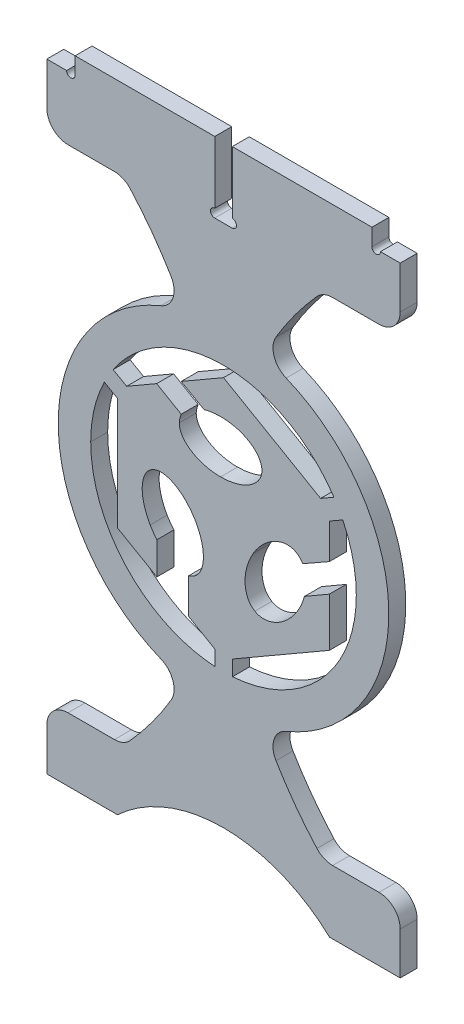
SolidWorks part; units mm, degrees
ref_plane "Front Plane" through (0, 0, 0) normal (0, 0, 1) x (1, 0, 0)
ref_plane "Top Plane" through (0, 0, 0) normal (0, 1, 0) x (1, 0, 0)
ref_plane "Right Plane" through (0, 0, 0) normal (1, 0, 0) x (0, 0, -1)
sketch "Leg_Profile" plane through (0, 0, 0) normal (0, 0, 1) x (1, 0, 0)
  line L0 (-125, 219) -> (125, -219) construction
  line L1 (-105, 231) -> (105, 231)
  line L2 (-125, 219) -> (-125, -219)
  line L3 (-125, -219) -> (-75, -219)
  line L4 (125, 219) -> (125, -219)
  line L5 (75, -219) -> (125, -219)
  line L8 (-125, 219) -> (-111, 219)
  line L9 (-105, 231) -> (-105, 219)
  line L12 (125, 219) -> (111, 219)
  line L13 (105, 231) -> (105, 219)
  arc A0 (75, -219) -> (-75, -219) centre (0, -299.4674) ccw
  arc A2 (-111, 219) -> (-105, 219) centre (-108, 219) ccw
  arc A3 (105, 219) -> (111, 219) centre (108, 219) ccw
  dimension "Dogbone_Radius" = 3
  dimension "Bottom_Arch_Radius" = 110
  dimension "Leg_Height" = 450
  dimension "Shoulder_Height" = 12
  dimension "Shoulder_Width" = 20
  dimension "Leg_Width" = 250
  dimension "Foot_Width" = 50
extrude "Leg_Extrude" add sketch "Leg_Profile" along normal blind 12
sketch "Sketch2" plane through (0, 0, 12) normal (0, 0, 1) x (1, 0, 0)
  line L0 (-50.1391, -37.6194) -> (-50.1391, -54.1629) construction
  line L1 (-50.1391, -54.1629) -> (-71.8697, -41.6194) construction
  line L2 (-71.8697, -41.6194) -> (-71.8697, 37.7466) construction
  line L3 (-71.8697, 37.7466) -> (-85.5342, 45.6353) construction
  line L4 (-3.0682, -96.887) -> (-3.0682, -81.3306) construction
  line L5 (-3.0682, -81.3306) -> (-21.6488, -70.608) construction
  line L6 (-21.6488, -70.608) -> (-21.6488, -49.3871) construction
  line L7 (85.5832, 45.5143) -> (71.8558, 37.5885) construction
  line L8 (71.8558, 37.5885) -> (71.8558, 12.7724) construction
  line L9 (71.8558, 12.7724) -> (56.8736, 4.2789) construction
  line L10 (59.8285, -21.0549) -> (71.8558, -14.0936) construction
  line L11 (71.8558, -14.0936) -> (71.8558, -41.6194) construction
  line L12 (71.8558, -41.6194) -> (3.3834, -81.1483) construction
  line L13 (3.3834, -81.1483) -> (3.3834, -96.8741) construction
  line L14 (-13.3569, 63.0869) -> (-23.8794, 69.0659) construction
  line L15 (-23.8794, 69.0659) -> (-0.0005, 82.8449) construction
  line L16 (-0.0005, 82.8449) -> (68.6736, 43.1966) construction
  line L17 (-68.5487, 43.2788) -> (-47.2858, 55.5514) construction
  line L18 (-47.2858, 55.5514) -> (-33.5439, 47.5885) construction
  line L19 (125, -219) -> (125, 219) construction
  line L20 (74.9, -219) -> (125, -219) construction
  line L21 (-68.5486, 46.7427) -> (-47.2829, 59.0169)
  line L22 (-47.2829, 59.0169) -> (-29.9326, 48.9632)
  line L23 (-13.7964, 59.8861) -> (-29.9167, 69.0458)
  line L24 (-29.9167, 69.0458) -> (-0.0001, 86.3087)
  line L25 (-0.0001, 86.3087) -> (68.673, 46.661)
  line L26 (-74.8697, -43.3516) -> (-74.8697, 36.0145)
  line L27 (-74.8697, 36.0145) -> (-84.3062, 41.4623)
  line L28 (-6.0682, -93.7416) -> (-6.0682, -83.0631)
  line L29 (-6.0682, -83.0631) -> (-24.6488, -72.3405)
  line L30 (-24.6488, -72.3405) -> (-24.6488, -47.3849)
  line L31 (-47.1391, -36.5489) -> (-47.1391, -59.3585)
  line L32 (-47.1391, -59.3585) -> (-74.8697, -43.3516)
  line L33 (57.2919, -19.0568) -> (74.8558, -8.891)
  line L34 (74.8558, -8.891) -> (74.8558, -43.3515)
  line L35 (74.8558, -43.3515) -> (6.3834, -82.8805)
  line L36 (6.3834, -82.8805) -> (6.3834, -93.7186)
  line L37 (84.3509, 41.3386) -> (74.8558, 35.8565)
  line L38 (74.8558, 35.8565) -> (74.8558, 11.0246)
  line L39 (74.8558, 11.0246) -> (56.2033, 0.4504)
  circle A0 centre (0, 0) radius 96.9332 construction
  spline S0 degree 3 poles (-21.6488, -49.3871) (-20.9811, -49.1097) (-20.3327, -48.8081) (-19.7085, -48.4371) knots 0 0 0 0 1 1 1 1 construction
  spline S1 degree 3 poles (-19.7085, -48.4371) (-9.4456, -42.4694) (-8.373, -25.1694) (-17.3133, -9.7711) knots 0 0 0 0 1 1 1 1 construction
  spline S2 degree 3 poles (-17.3133, -9.7711) (-26.2536, 5.6144) (-41.823, 13.2628) (-52.0858, 7.3031) knots 0 0 0 0 1 1 1 1 construction
  spline S3 degree 3 poles (-52.0858, 7.3031) (-62.3487, 1.3499) (-63.4149, -15.9646) (-54.4745, -31.363) knots 0 0 0 0 1 1 1 1 construction
  spline S4 degree 3 poles (-54.4745, -31.363) (-53.1568, -33.6242) (-51.6955, -35.7162) (-50.1391, -37.6194) knots 0 0 0 0 1 1 1 1 construction
  spline S5 degree 3 poles (-85.5342, 45.6353) (-92.8116, 32.0321) (-96.9503, 16.495) (-96.9503, -0.0179) knots 0 0 0 0 1 1 1 1 construction
  spline S6 degree 3 poles (-96.9503, -0.0179) (-96.9503, -52.5323) (-55.1858, -95.2612) (-3.0682, -96.887) knots 0 0 0 0 1 1 1 1 construction
  spline S7 degree 3 poles (56.8736, 4.2789) (55.7833, 5.5515) (54.5043, 6.6418) (53.043, 7.4918) knots 0 0 0 0 1 1 1 1 construction
  spline S8 degree 3 poles (53.043, 7.4918) (42.7785, 13.4531) (27.2108, 5.8031) (18.2705, -9.5824) knots 0 0 0 0 1 1 1 1 construction
  spline S9 degree 3 poles (18.2705, -9.5824) (9.3302, -24.9807) (10.4011, -42.2871) (20.6592, -48.2532) knots 0 0 0 0 1 1 1 1 construction
  spline S10 degree 3 poles (20.6592, -48.2532) (30.9221, -54.2081) (46.4898, -46.5645) (55.4301, -31.1726) knots 0 0 0 0 1 1 1 1 construction
  spline S11 degree 3 poles (55.4301, -31.1726) (57.3639, -27.8468) (58.8268, -24.4323) (59.8285, -21.0549) knots 0 0 0 0 1 1 1 1 construction
  spline S12 degree 3 poles (3.3834, -96.8741) (55.3478, -95.0903) (96.9364, -52.4178) (96.9364, -0.0179) knots 0 0 0 0 1 1 1 1 construction
  spline S13 degree 3 poles (96.9364, -0.0179) (96.9364, 16.445) (92.8171, 31.9385) (85.5832, 45.5143) knots 0 0 0 0 1 1 1 1 construction
  spline S14 degree 3 poles (30.1656, 42.9579) (30.1656, 54.8272) (15.7318, 64.4417) (-2.0666, 64.4417) knots 0 0 0 0 1 1 1 1 construction
  spline S15 degree 3 poles (-2.0666, 64.4417) (-6.0359, 64.4417) (-9.8359, 63.9627) (-13.3569, 63.0869) knots 0 0 0 0 1 1 1 1 construction
  spline S16 degree 3 poles (68.6736, 43.1966) (73.8849, 46.2078) (78.5591, 48.9046) (82.3574, 51.103) knots 0 0 0 0 1 1 1 1 construction
  spline S17 degree 3 poles (82.3574, 51.103) (65.2526, 78.6046) (34.772, 96.9255) (-0.0005, 96.9255) knots 0 0 0 0 1 1 1 1 construction
  spline S18 degree 3 poles (-0.0005, 96.9255) (-34.7278, 96.9255) (-65.1777, 78.6546) (-82.2971, 51.2175) knots 0 0 0 0 1 1 1 1 construction
  spline S19 degree 3 poles (-82.2971, 51.2175) (-78.3648, 48.9417) (-73.6777, 46.2401) (-68.5487, 43.2788) knots 0 0 0 0 1 1 1 1 construction
  spline S20 degree 3 poles (-33.5439, 47.5885) (-34.0359, 46.0949) (-34.3004, 44.5514) (-34.3004, 42.9579) knots 0 0 0 0 1 1 1 1 construction
  spline S21 degree 3 poles (-34.3004, 42.9579) (-34.3004, 31.0934) (-19.8714, 21.4724) (-2.0666, 21.4724) knots 0 0 0 0 1 1 1 1 construction
  spline S22 degree 3 poles (-2.0666, 21.4724) (15.7318, 21.4724) (30.1656, 31.0934) (30.1656, 42.9579) knots 0 0 0 0 1 1 1 1 construction
  spline S23 degree 1 poles (-0.0005, 93.9255) (-78.0652, 52.236) knots 0 0 1 1 construction
  spline S24 degree 1 poles (-78.0652, 52.236) (-68.5486, 46.7427) knots 0 0 1 1 construction
  spline S25 degree 1 poles (-29.9326, 48.9632) (-31.3004, 42.9579) knots 0 0 1 1 construction
  spline S26 degree 1 poles (-31.3004, 42.9579) (-2.0666, 24.4724) knots 0 0 1 1 construction
  spline S27 degree 1 poles (-2.0666, 24.4724) (27.1656, 42.9579) knots 0 0 1 1 construction
  spline S28 degree 1 poles (27.1656, 42.9579) (-2.0666, 61.4417) knots 0 0 1 1 construction
  spline S29 degree 1 poles (-2.0666, 61.4417) (-13.7964, 59.8861) knots 0 0 1 1 construction
  spline S30 degree 1 poles (68.673, 46.661) (78.1297, 52.1235) knots 0 0 1 1 construction
  spline S31 degree 1 poles (78.1297, 52.1235) (-0.0005, 93.9255) knots 0 0 1 1 construction
  spline S32 degree 3 poles (-0.0005, 93.9255) (-2.0204, 93.9255) (-6.0815, 93.7961) (-14.0095, 93.0355) (-23.6501, 91.1738) (-34.6606, 87.5753) (-45.0327, 82.705) (-54.6709, 76.656) (-63.4834, 69.5198) (-71.3714, 61.3972) (-75.9626, 55.3706) (-78.0652, 52.236) knots 0 0 0 0 0.060435 0.120869 0.241739 0.362608 0.483478 0.604347 0.725216 0.846086 0.966955 0.966955 0.966955 0.966955
  spline S33 degree 3 poles (-78.0652, 52.236) (-77.6994, 52.0246) (-76.9746, 51.606) (-75.4696, 50.737) (-73.5234, 49.6137) (-71.0957, 48.2128) (-69.3904, 47.2286) (-68.5486, 46.7427) knots 0.222315 0.222315 0.222315 0.222315 0.307237 0.392159 0.562002 0.731846 0.901689 0.901689 0.901689 0.901689
  spline S34 degree 3 poles (-29.9326, 48.9632) (-30.0259, 48.6801) (-30.212, 48.1147) (-30.4463, 47.4041) (-30.6075, 46.9138) (-30.7038, 46.6226) (-30.8078, 46.2982) (-31.025, 45.5281) (-31.2393, 44.3846) (-31.3004, 43.4312) (-31.3004, 42.9579) knots -0.516261 -0.516261 -0.516261 -0.516261 -0.326728 -0.137196 -0.04243 0.004954 0.052337 0.241869 0.620935 1 1 1 1
  spline S35 degree 3 poles (-31.3004, 42.9579) (-31.3004, 40.6032) (-30.253, 37.226) (-26.8485, 33.0303) (-23.3378, 30.1895) (-18.9778, 27.7846) (-13.899, 25.9379) (-9.1735, 24.9521) (-5.1821, 24.543) (-3.0983, 24.4724) (-2.0666, 24.4724) knots 0 0 0 0 0.25 0.375 0.5 0.625 0.75 0.875 0.9375 1 1 1 1
  spline S36 degree 3 poles (-2.0666, 24.4724) (-1.0352, 24.4724) (1.0477, 24.543) (5.038, 24.9521) (9.7627, 25.9378) (14.8412, 27.7846) (19.2015, 30.1896) (22.7127, 33.0304) (26.1179, 37.2264) (27.1656, 40.6032) (27.1656, 42.9579) knots 0 0 0 0 0.0625 0.125 0.25 0.375 0.5 0.625 0.75 1 1 1 1
  spline S37 degree 3 poles (27.1656, 42.9579) (27.1656, 45.3131) (26.1178, 48.6916) (22.7128, 52.8868) (19.2018, 55.727) (14.8416, 58.1312) (9.7631, 59.9771) (5.0383, 60.9623) (1.0479, 61.3711) (-1.0352, 61.4417) (-2.0666, 61.4417) knots 0 0 0 0 0.25 0.375 0.5 0.625 0.75 0.875 0.9375 1 1 1 1
  spline S38 degree 3 poles (-2.0666, 61.4417) (-3.088, 61.4417) (-5.1517, 61.3721) (-8.112, 61.072) (-10.5161, 60.662) (-12.1106, 60.307) (-13.0586, 60.0693) (-13.5521, 59.9469) (-13.7964, 59.8861) knots 0 0 0 0 0.277541 0.555083 0.832624 0.971395 1.04078 1.110166 1.110166 1.110166 1.110166
  spline S39 degree 3 poles (68.673, 46.661) (69.5181, 47.1492) (71.2339, 48.1402) (73.654, 49.5379) (75.5811, 50.6509) (77.0626, 51.5068) (77.7713, 51.9164) (78.1297, 52.1235) knots 0.096942 0.096942 0.096942 0.096942 0.26579 0.434637 0.603485 0.687909 0.772332 0.772332 0.772332 0.772332
  spline S40 degree 3 poles (78.1297, 52.1235) (76.0287, 55.266) (71.4389, 61.3083) (63.5495, 69.4522) (54.7322, 76.6076) (45.0863, 82.6732) (34.7038, 87.5571) (23.6805, 91.1658) (14.0277, 93.0329) (6.0891, 93.7957) (2.0223, 93.9255) (-0.0005, 93.9255) knots 0.032946 0.032946 0.032946 0.032946 0.153827 0.274709 0.395591 0.516473 0.637355 0.758236 0.879118 0.939559 1 1 1 1
  spline S41 degree 1 poles (-84.3062, 41.4623) (-93.9503, -0.0179) knots 0 0 1 1 construction
  spline S42 degree 1 poles (-93.9503, -0.0179) (-6.0682, -93.7416) knots 0 0 1 1 construction
  spline S43 degree 1 poles (-24.6488, -47.3849) (-21.2289, -45.8509) knots 0 0 1 1 construction
  spline S44 degree 1 poles (-21.2289, -45.8509) (-19.9075, -11.2779) knots 0 0 1 1 construction
  spline S45 degree 1 poles (-19.9075, -11.2779) (-50.5799, 4.7084) knots 0 0 1 1 construction
  spline S46 degree 1 poles (-50.5799, 4.7084) (-51.8813, -29.8546) knots 0 0 1 1 construction
  spline S47 degree 1 poles (-51.8813, -29.8546) (-47.1391, -36.5489) knots 0 0 1 1 construction
  spline S48 degree 3 poles (-84.3062, 41.4623) (-85.8545, 38.3233) (-88.5935, 31.8911) (-91.6348, 21.6947) (-93.2019, 12.8259) (-93.8416, 5.5512) (-93.9503, 1.8325) (-93.9503, -0.0179) knots 0.069065 0.069065 0.069065 0.069065 0.301799 0.534533 0.767266 0.883633 1 1 1 1
  spline S49 degree 3 poles (-93.9503, -0.0179) (-93.9503, -1.5676) (-93.8744, -4.6799) (-93.4262, -10.7921) (-92.3236, -18.2817) (-90.1746, -26.9661) (-86.2639, -38.0956) (-79.519, -51.0583) (-68.7877, -64.7624) (-55.7556, -76.2767) (-43.2611, -83.7665) (-32.4527, -88.3284) (-23.9828, -90.9934) (-16.6512, -92.5496) (-10.6516, -93.3744) (-7.594, -93.6443) (-6.0682, -93.7416) knots 0 0 0 0 0.03061 0.061219 0.122438 0.183657 0.244876 0.367315 0.489753 0.612191 0.734629 0.795848 0.857068 0.918287 0.948896 0.979506 0.979506 0.979506 0.979506
  spline S50 degree 3 poles (-24.6488, -47.3849) (-24.3267, -47.2511) (-23.6908, -46.9856) (-22.687, -46.5743) (-21.9176, -46.2328) (-21.4572, -45.9866) (-21.2289, -45.8509) knots -0.923008 -0.923008 -0.923008 -0.923008 -0.440615 0.041778 0.524171 1.006564 1.006564 1.006564 1.006564
  spline S51 degree 3 poles (-21.2289, -45.8509) (-19.1903, -44.6655) (-16.7868, -42.0627) (-14.8661, -37.0113) (-14.1704, -32.5488) (-14.279, -27.5704) (-15.2319, -22.2502) (-16.7525, -17.6674) (-18.4035, -14.0089) (-19.3892, -12.1705) (-19.9075, -11.2779) knots -0.000401 -0.000401 -0.000401 -0.000401 0.249696 0.374745 0.499794 0.624843 0.749891 0.87494 0.937465 0.999989 0.999989 0.999989 0.999989
  spline S52 degree 3 poles (-19.9075, -11.2779) (-20.4256, -10.3863) (-21.5329, -8.6212) (-23.891, -5.3772) (-27.1167, -1.788) (-31.2647, 1.675) (-35.5348, 4.2367) (-39.7555, 5.8455) (-45.0952, 6.6821) (-48.5429, 5.8913) (-50.5799, 4.7084) knots 0.000011 0.000011 0.000011 0.000011 0.062511 0.125012 0.250013 0.375014 0.500015 0.625016 0.750018 1.00002 1.00002 1.00002 1.00002
  spline S53 degree 3 poles (-50.5799, 4.7084) (-52.6159, 3.5274) (-55.0103, 0.9274) (-56.928, -4.1229) (-57.6209, -8.5855) (-57.5103, -13.5643) (-56.5561, -18.8846) (-55.0352, -23.4669) (-53.3846, -27.1246) (-52.3994, -28.9622) (-51.8813, -29.8546) knots -0.00002 -0.00002 -0.00002 -0.00002 0.249973 0.37497 0.499966 0.624963 0.749959 0.874956 0.937454 0.999952 0.999952 0.999952 0.999952
  spline S54 degree 3 poles (-51.8813, -29.8546) (-51.5302, -30.457) (-50.795, -31.6545) (-49.6451, -33.349) (-48.6303, -34.7102) (-47.8208, -35.7183) (-47.3618, -36.2765) (-47.1391, -36.5489) knots 0.000325 0.000325 0.000325 0.000325 0.286528 0.572731 0.858933 1.002035 1.145136 1.145136 1.145136 1.145136
  spline S55 degree 1 poles (51.5355, 4.8981) (20.8646, -11.0892) knots 0 0 1 1 construction
  spline S56 degree 1 poles (20.8646, -11.0892) (22.1661, -45.6592) knots 0 0 1 1 construction
  spline S57 degree 1 poles (22.1661, -45.6592) (52.8363, -29.6652) knots 0 0 1 1 construction
  spline S58 degree 1 poles (52.8363, -29.6652) (57.2919, -19.0568) knots 0 0 1 1 construction
  spline S59 degree 1 poles (6.3834, -93.7186) (93.9364, -0.0179) knots 0 0 1 1 construction
  spline S60 degree 1 poles (93.9364, -0.0179) (84.3509, 41.3386) knots 0 0 1 1 construction
  spline S61 degree 1 poles (56.2033, 0.4504) (51.5355, 4.8981) knots 0 0 1 1 construction
  spline S62 degree 3 poles (51.5355, 4.8981) (49.4983, 6.081) (46.0501, 6.8716) (40.7108, 6.0346) (36.4905, 4.4256) (32.2208, 1.8637) (28.0733, -1.5994) (24.8479, -5.1887) (22.49, -8.4326) (21.3827, -10.1976) (20.8646, -11.0892) knots 0.000036 0.000036 0.000036 0.000036 0.250024 0.375019 0.500013 0.625007 0.750001 0.874995 0.937492 0.999989 0.999989 0.999989 0.999989
  spline S63 degree 3 poles (20.8646, -11.0892) (20.3466, -11.9814) (19.3613, -13.819) (17.7108, -17.4761) (16.1901, -22.0575) (15.2362, -27.3767) (15.1258, -32.3549) (15.8186, -36.8179) (17.7361, -41.8706) (20.13, -44.4746) (22.1661, -45.6592) knots 0.000011 0.000011 0.000011 0.000011 0.062507 0.125003 0.249995 0.374986 0.499978 0.62497 0.749962 0.999946 0.999946 0.999946 0.999946
  spline S64 degree 3 poles (22.1661, -45.6592) (24.2036, -46.841) (27.6512, -47.6302) (32.9908, -46.7927) (37.211, -45.1835) (41.4805, -42.6214) (45.6279, -39.158) (48.8531, -35.5679) (51.211, -32.323) (52.3182, -30.5571) (52.8363, -29.6652) knots 0.000054 0.000054 0.000054 0.000054 0.250044 0.375039 0.500034 0.625029 0.750024 0.875018 0.937516 1.000013 1.000013 1.000013 1.000013
  spline S65 degree 3 poles (52.8363, -29.6652) (53.3352, -28.8072) (54.2862, -27.0406) (55.4863, -24.4098) (56.3251, -22.1906) (56.8116, -20.6818) (57.0813, -19.7656) (57.2222, -19.2918) (57.2919, -19.0568) knots -0.000061 -0.000061 -0.000061 -0.000061 0.278209 0.55648 0.834751 0.973886 1.043453 1.113021 1.113021 1.113021 1.113021
  spline S66 degree 3 poles (6.3834, -93.7186) (7.9044, -93.6166) (10.952, -93.3377) (16.932, -92.4965) (24.2389, -90.9227) (32.6794, -88.241) (43.4491, -83.6626) (55.8972, -76.1622) (68.8786, -64.6493) (79.5665, -50.9591) (86.2833, -38.0167) (90.1773, -26.908) (92.3169, -18.2412) (93.4147, -10.7677) (93.8609, -4.6691) (93.9364, -1.5641) (93.9364, -0.0179) knots 0.020619 0.020619 0.020619 0.020619 0.051224 0.08183 0.143041 0.204253 0.265464 0.387887 0.510309 0.632732 0.755155 0.816366 0.877577 0.938789 0.969394 1 1 1 1
  spline S67 degree 3 poles (93.9364, -0.0179) (93.9364, 1.8262) (93.8284, 5.5323) (93.1922, 12.7832) (91.6341, 21.624) (88.611, 31.791) (85.8892, 38.2069) (84.3509, 41.3386) knots 0 0 0 0 0.116328 0.232655 0.46531 0.697965 0.930621 0.930621 0.930621 0.930621
  spline S68 degree 3 poles (56.2033, 0.4504) (56.0001, 0.6876) (55.5922, 1.1636) (55.0893, 1.7507) (54.7244, 2.1763) (54.5359, 2.3968) (54.2924, 2.6727) (53.7209, 3.2759) (52.7908, 4.091) (51.9642, 4.6486) (51.5355, 4.8981) knots -0.491558 -0.491558 -0.491558 -0.491558 -0.305145 -0.118732 -0.025526 0.021078 0.067681 0.254094 0.62692 0.999745 0.999745 0.999745 0.999745
  dimension "D1" = 3
extrude "Cut-Extrude1" cut sketch "Sketch2" against normal through all
sketch "Sketch3" plane through (0, 0, 12) normal (0, 0, 1) x (1, 0, 0)
  line L0 (-146.6617, 174) -> (-43.6617, 174) construction
  line L1 (-110, 174) -> (-77.1707, 174)
  line L2 (-125, 219) -> (-125, -219) construction
  line L3 (-125, 189) -> (-125, 0)
  line L4 (-116.9332, 0) -> (-125, 0)
  circle A0 centre (0, 0) radius 96.9332 construction
  arc A1 (-18.4711, 95.157) -> (-18.4711, -95.157) centre (0, 0) ccw construction
  arc A2 (-44.3006, 108.2166) -> (-116.9332, 0) centre (0, 0) ccw
  arc A3 (-44.3006, 108.2166) -> (-37.1067, 129.7918) centre (-49.9834, 122.0984) ccw
  arc A4 (-125, 189) -> (-110, 174) centre (-110, 189) ccw
  arc A5 (-66.067, 169.0851) -> (-77.1707, 174) centre (-77.1707, 159) ccw
  circle A6 centre (0, 0) radius 116.9332 construction
  circle A7 centre (0, 0) radius 96.9332 construction
  arc A8 (-37.1067, 129.7918) -> (-66.067, 169.0851) centre (-254.344, 0) ccw
  dimension "D1" = 20
  dimension "D2" = 30
  dimension "D3" = 30
extrude "Cut-Extrude3" cut sketch "Sketch3" against normal through all
mirror "Mirror1" about plane through (0, 0, 0) normal (1, 0, 0) of "Cut-Extrude3"
sketch "Crossbrace_Slot" plane through (0, 0, 12) normal (0, 0, 1) x (1, 0, 0)
  line L1 (-6.2, 231) -> (6.2, 231)
  line L2 (-6.2, 231) -> (-6.2, 187)
  line L3 (-6.2, 181) -> (6.2, 181)
  line L4 (6.2, 231) -> (6.2, 187)
  line L5 (-105, 231) -> (105, 231) construction
  arc A0 (-6.2, 187) -> (-6.2, 181) centre (-6.2, 184) ccw
  arc A1 (6.2, 181) -> (6.2, 187) centre (6.2, 184) ccw
  arc A2 (-111, 219) -> (-105, 219) centre (-108, 219) ccw construction
  point P4 (0, 231)
  dimension "Crossbrace_Slot_Length" = 50
  dimension "Crossbrace_Slot_Thickness" = 12.4
extrude "Cut-Extrude5" cut sketch "Crossbrace_Slot" against normal through all
mirror "Mirror2" about plane through (0, 0, 0) normal (0, 1, 0) of "Mirror1", "Cut-Extrude3"
equation "\"Shoulder_Height@Leg_Profile\"= \"material_thickness@Table.SLDASM\""
equation "\"Shoulder_Width@Leg_Profile\" = \"leg_shoulder@Table.SLDASM\""
equation "\"Leg_Height@Leg_Profile\" = \"table_height@Table.SLDASM\""
equation "\"Leg_Width@Leg_Profile\" = \"leg_width@Table.SLDASM\""
equation "\"D1@Leg_Extrude\" = \"material_thickness@Table.SLDASM\""
equation "\"Dogbone_Radius@Leg_Profile\" = \"cutter_diameter@Table.SLDASM\" / 2"
equation "\"Crossbrace_Slot_Length@Crossbrace_Slot\" = \"crossbrace_length@Table.SLDASM\" / 2"
equation "\"Crossbrace_Slot_Thickness@Crossbrace_Slot\"= \"material_thickness@Table.SLDASM\" - ( 2 * \"interference@Table.SLDASM\" )"
equation "\"Foot_Width@Leg_Profile\"= \"foot_width@Table.SLDASM\""
equation "\"Bottom_Arch_Radius@Leg_Profile\"= \"bottom_arch_diameter@Table.SLDASM\" / 2"
